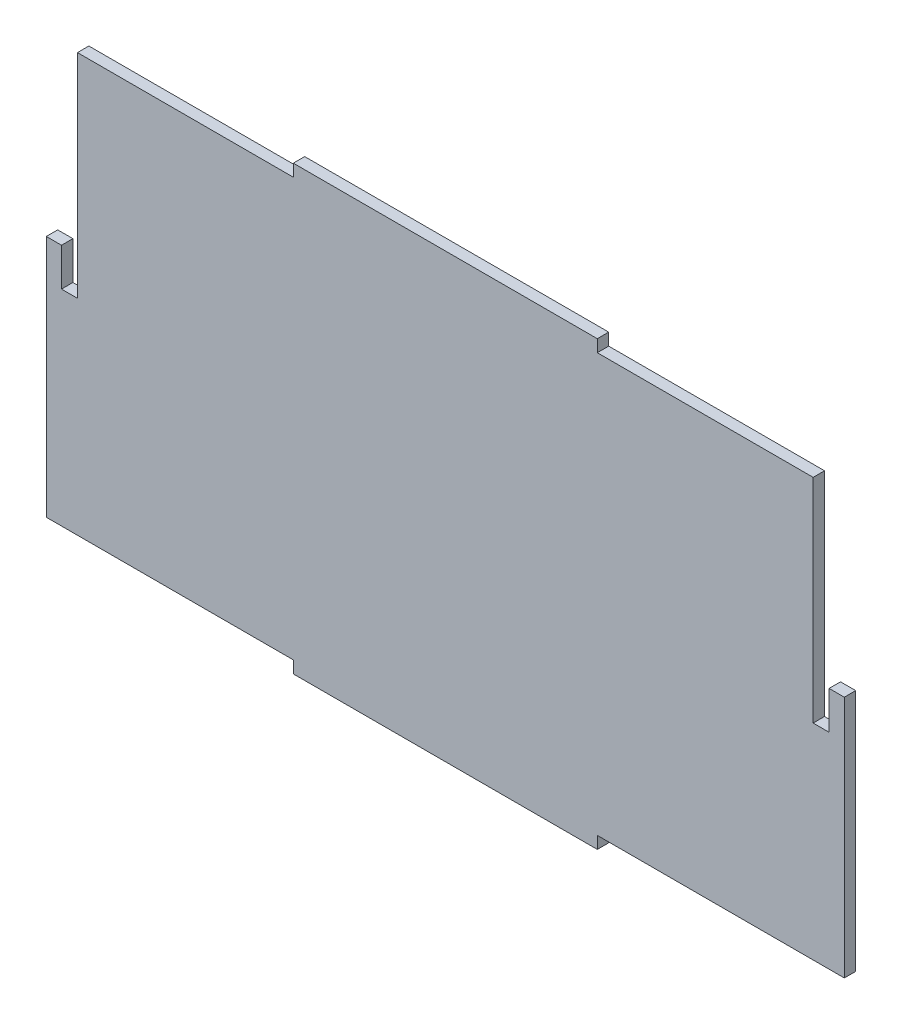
SolidWorks part; units mm, degrees
ref_plane "Plan de face" through (0, 0, 0) normal (0, 0, 1) x (1, 0, 0)
ref_plane "Plan de dessus" through (0, 0, 0) normal (0, 1, 0) x (1, 0, 0)
ref_plane "Plan de droite" through (0, 0, 0) normal (1, 0, 0) x (0, 0, -1)
sketch "Esquisse1" plane through (0, 0, 0) normal (0, 0, 1) x (1, 0, 0)
  line L0 (-52.5, 27.5) -> (52.5, -27.5) construction
  line L1 (-52.5, 27.5) -> (-50.5, 27.5)
  line L2 (-52.5, 27.5) -> (-52.5, -27.5)
  line L3 (-52.5, -27.5) -> (-20, -27.5)
  line L4 (52.5, 27.5) -> (52.5, -27.5)
  line L5 (0, 0) -> (0, -53.5236) construction
  line L7 (-20, -27.5) -> (-20, -29.1)
  line L8 (-20, -29.1) -> (20, -29.1)
  line L9 (20, -27.5) -> (20, -29.1)
  line L10 (20, -27.5) -> (52.5, -27.5)
  line L11 (48.4, 27.5) -> (48.4, -0.5)
  line L13 (-50.5, 27.5) -> (-50.5, -0.5)
  line L14 (-50.5, -0.5) -> (-48.4, -0.5)
  line L15 (-48.4, 27.5) -> (-48.4, -0.5)
  line L16 (50.5, -0.5) -> (48.4, -0.5)
  line L17 (50.5, 27.5) -> (50.5, -0.5)
  line L19 (-48.4, 27.5) -> (-20, 27.5)
  line L20 (50.5, 27.5) -> (52.5, 27.5)
  line L21 (0, 0) -> (24.5194, 0) construction
  line L22 (20, 27.5) -> (20, 29.1)
  line L23 (-20, 29.1) -> (20, 29.1)
  line L24 (-20, 27.5) -> (-20, 29.1)
  line L25 (20, 27.5) -> (48.4, 27.5)
  dimension "D1" = 55
  dimension "D2" = 105
  dimension "D3" = 40
  dimension "D4" = 1.6
  dimension "D5" = 2.1
  dimension "D6" = 28
  dimension "D7" = 2
extrude "Boss.-Extru.1" add sketch "Esquisse1" along normal blind 1.5
sketch "Esquisse2" plane through (0, 0, 1.5) normal (0, 0, 1) x (1, 0, 0)
  line L0 (-50.5, -0.5) -> (-50.5, 27.5) construction
  line L1 (-52.5, 27.5) -> (-50.5, 27.5)
  line L2 (-52.5, 27.5) -> (-52.5, 4.5)
  line L3 (-52.5, 4.5) -> (-50.5, 4.5)
  line L4 (-50.5, 27.5) -> (-50.5, 4.5)
  line L5 (-48.4, -0.5) -> (-50.5, -0.5) construction
  line L6 (0, 0) -> (0, 35.9014) construction
  line L7 (50.5, 27.5) -> (50.5, 4.5)
  line L8 (52.5, 4.5) -> (50.5, 4.5)
  line L9 (52.5, 27.5) -> (52.5, 4.5)
  line L10 (52.5, 27.5) -> (50.5, 27.5)
  dimension "D1" = 5
extrude "Enlèv. mat.-Extru.1" cut sketch "Esquisse2" against normal blind 10
